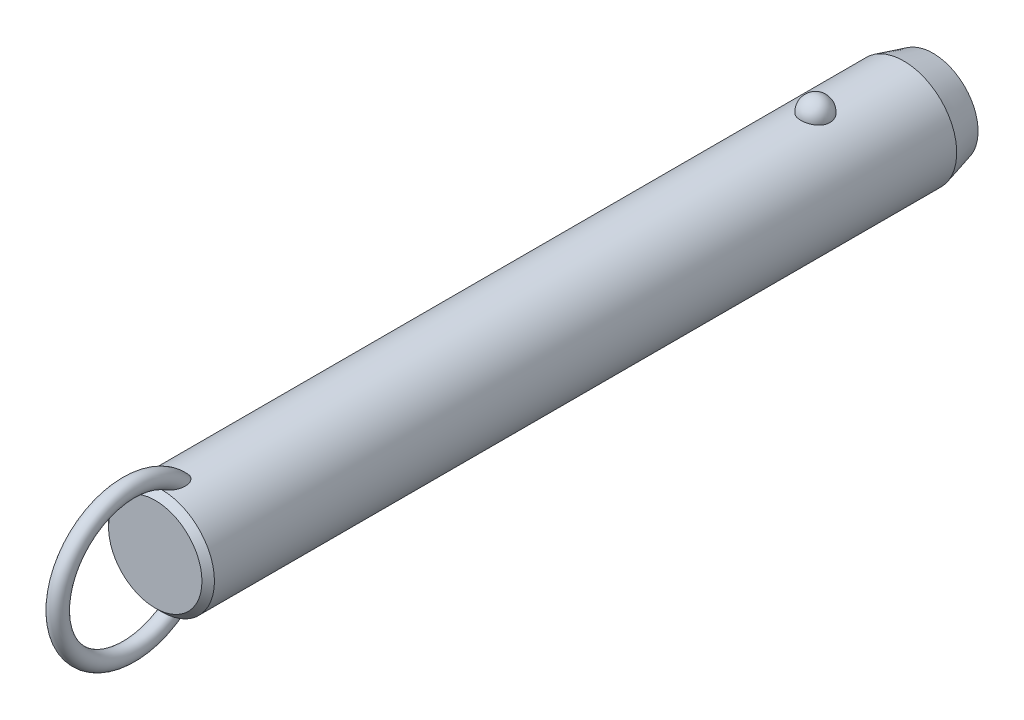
SolidWorks part; units mm, degrees
ref_plane "Front Plane" through (0, 0, 0) normal (0, 0, 1) x (1, 0, 0)
ref_plane "Top Plane" through (0, 0, 0) normal (0, 1, 0) x (1, 0, 0)
ref_plane "Right Plane" through (0, 0, 0) normal (1, 0, 0) x (0, 0, -1)
sketch "Sketch2" plane through (0, 0, 0) normal (0, 0, 1) x (1, 0, 0)
  circle A0 centre (0, 0) radius 12.7
  point P3 (0, 12.7)
  dimension "D1" = 25.4
extrude "Boss-Extrude1" add sketch "Sketch2" along normal blind 142.2
sketch "Sketch3" plane through (0, 0, 0) normal (0, 0, -1) x (-1, 0, 0)
  circle A0 centre (0, 0) radius 12.7
  dimension "D1" = 25.4
extrude "Boss-Extrude2" add sketch "Sketch3" along normal blind 31.7
chamfer "Chamfer1" distance 7 angle 15 1 edges at (-12.7, 0, -31.7)
sketch "Sketch12" plane through (0, 0, 0) normal (1, 0, 0) x (0, 0, -1)
  line L0 (-142.2, 12.7) -> (-142.2, -12.7) construction
  point P0 (-142.2, 0)
sketch "Sketch13" plane through (0, 0, 0) normal (1, 0, 0) x (0, 0, -1)
  circle A0 centre (-161.25, 0) radius 19.05
  point P2 (-142.2, 0)
  dimension "D1" = 38.1
sketch "Sketch14" plane through (0, 0, 0) normal (0, 1, 0) x (1, 0, 0)
  circle A0 centre (0, -144.2) radius 2
  point P2 (0, -142.2)
  dimension "D1" = 4
sweep "Sweep1" add profiles "Sketch14" path "Sketch13"
sketch "Sketch15" plane through (0, 0, 142.2) normal (0, 0, 1) x (1, 0, 0)
  circle A0 centre (0, 0) radius 12.7
  dimension "D1" = 25.4
extrude "Boss-Extrude3" add sketch "Sketch15" along normal blind 12.7
chamfer "Chamfer2" distance 1.5 angle 45 1 edges at (12.7, 0, 154.9)
sketch "Sketch18" plane through (0, 0, 0) normal (1, 0, 0) x (0, 0, -1)
  line L0 (24.7, 12.7) -> (-147.051, 12.7) construction
  line L1 (3.5, 16.2) -> (3.5, 9.2)
  line L2 (-147.051, -12.7) -> (24.7, -12.7) construction
  arc A0 (3.5, 16.2) -> (3.5, 9.2) centre (3.5, 12.7) ccw
  point P4 (0, 12.7)
  dimension "D1" = 28.9
revolve "Revolve1" add sketch "Sketch18" angle 360 about L1
